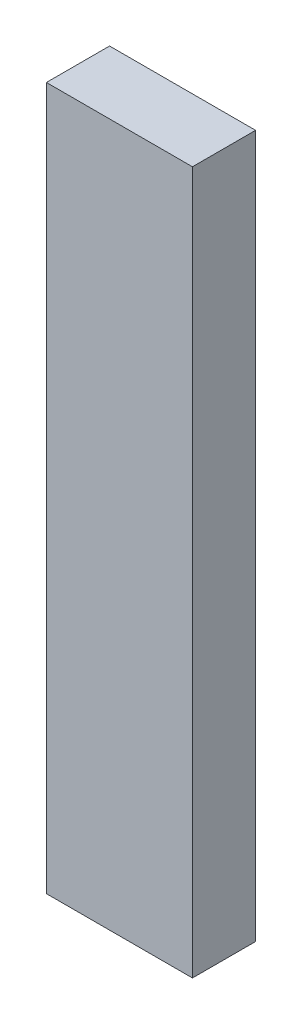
SolidWorks part; units mm, degrees
ref_plane "Plan de face" through (0, 0, 0) normal (0, 0, 1) x (1, 0, 0)
ref_plane "Plan de dessus" through (0, 0, 0) normal (0, 1, 0) x (1, 0, 0)
ref_plane "Plan de droite" through (0, 0, 0) normal (1, 0, 0) x (0, 0, -1)
sketch "Esquisse1" plane through (0, 0, 0) normal (0, 0, 1) x (1, 0, 0)
  line L1 (0, 0) -> (18.5, 0)
  line L2 (0, 0) -> (0, 89)
  line L3 (0, 89) -> (18.5, 89)
  line L4 (18.5, 0) -> (18.5, 89)
  dimension "D1" = 18.5
  dimension "D2" = 89
extrude "Extrusion1" add sketch "Esquisse1" along normal blind 8
